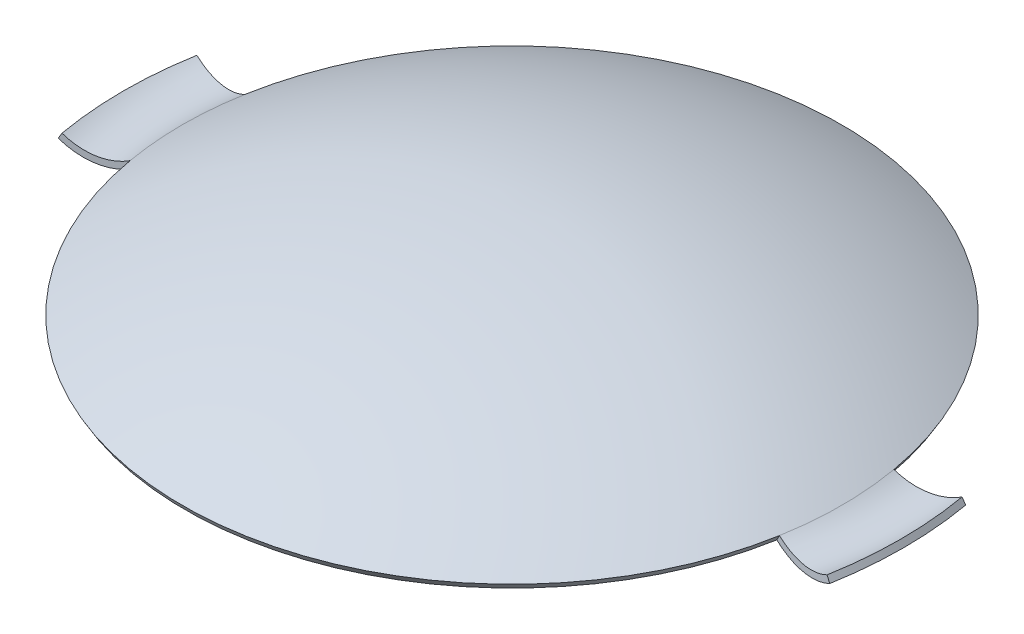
SolidWorks part; units mm, degrees
ref_plane "Ebene1" through (0, 0, 0) normal (0, 0, 1) x (1, 0, 0)
ref_plane "Ebene2" through (0, 0, 0) normal (0, 1, 0) x (1, 0, 0)
ref_plane "Ebene3" through (0, 0, 0) normal (1, 0, 0) x (0, 0, -1)
sketch "Skizze5" plane through (0, 0, 0) normal (0, 0, 1) x (1, 0, 0)
  line L0 (0, 0) -> (0, -200) construction
  line L2 (-101, -25.0629) -> (-100, -26.7949)
  line L4 (0, 2) -> (0, 0)
  arc A2 (0, 0) -> (-100, -26.7949) centre (0, -200) ccw
  arc A3 (0, 2) -> (-101, -25.0629) centre (0, -200) ccw
  dimension "D2" = 200
  dimension "D3" = 2
  dimension "D1" = 200
revolve "Rotation4" add sketch "Skizze5" angle 360 about L0
sketch "Skizze6" plane through (0, 0, 0) normal (0, 0, 1) x (1, 0, 0)
  line L0 (-101, -25.0629) -> (-100, -26.7949) construction
  line L1 (-101, -25.0629) -> (-100, -26.7949)
  line L2 (-99.5, -24.1968) -> (-101, -25.0629) construction
  line L3 (-98.5, -25.9289) -> (-100, -26.7949) construction
  line L4 (-119, -25.0629) -> (-120, -26.7949)
  arc A0 (-100, -26.7949) -> (-120, -26.7949) centre (-110, -9.4744) cw
  arc A1 (0, 0) -> (-100, -26.7949) centre (0, -200) ccw construction
  arc A2 (-101, -25.0629) -> (-119, -25.0629) centre (-110, -9.4744) cw
  dimension "D1" = 20
  dimension "D2" = 60
  dimension "D3" = 2
revolve "Rotation5" add sketch "Skizze6" angle 20 mid plane
mirror "Spiegeln1" about plane through (0, 0, 0) normal (1, 0, 0) of "Rotation5"
